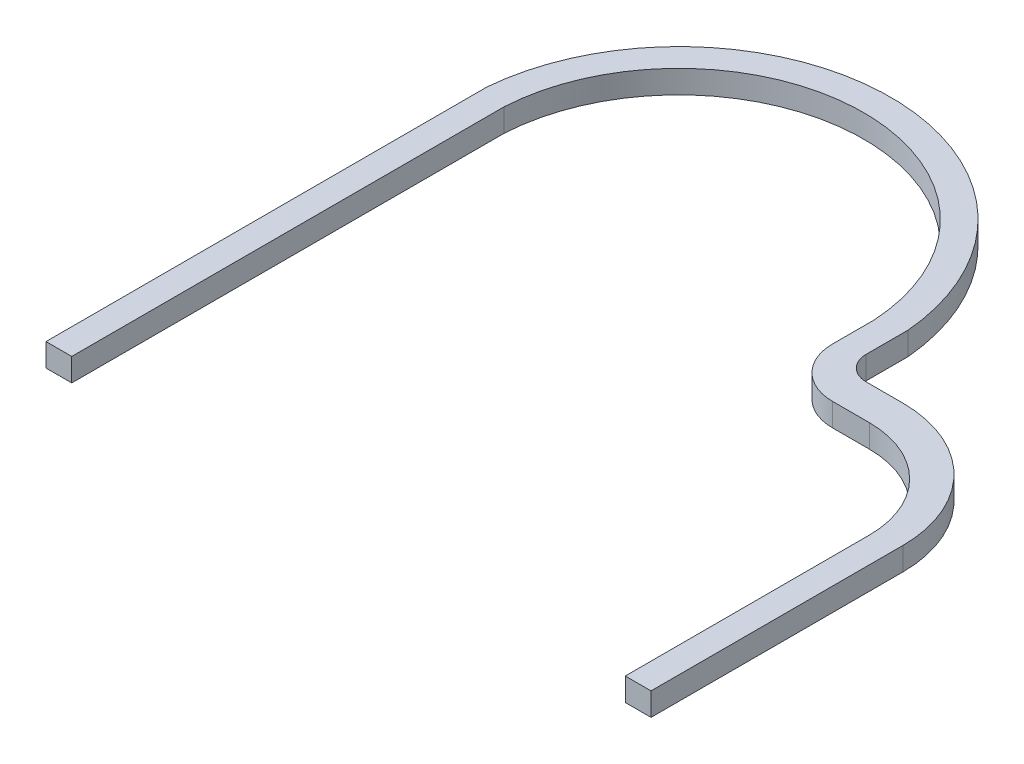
SolidWorks part; units mm, degrees
ref_plane "Front Plane" through (0, 0, 0) normal (0, 0, 1) x (1, 0, 0)
ref_plane "Top Plane" through (0, 0, 0) normal (0, 1, 0) x (1, 0, 0)
ref_plane "Right Plane" through (0, 0, 0) normal (1, 0, 0) x (0, 0, -1)
sketch "circuit outline" plane through (0, 0, 0) normal (0, 1, 0) x (1, 0, 0)
  line L0 (-69.85, 0) -> (-69.85, 15.875)
  line L1 (0, -31.75) -> (-69.85, -31.75)
  line L2 (0, -31.75) -> (0, 0)
  line L3 (0, 0) -> (-17.78, 0)
  line L4 (-69.85, -31.75) -> (-69.85, 0)
  line L5 (-25.4, 15.875) -> (-25.4, 7.62)
  arc A0 (-25.4, 15.875) -> (-69.85, 15.875) centre (-47.625, 15.875) ccw
  arc A1 (-17.78, 0) -> (-25.4, 7.62) centre (-17.78, 7.62) cw
  point P6 (-47.625, 38.1)
  dimension "D3" = 44.45
  dimension "D5" = 7.62
  dimension "D1" = 38.1
  dimension "D2" = 69.85
  dimension "D4" = 31.75
sketch "Sketch2" plane through (0, 0, 0) normal (0, 1, 0) x (1, 0, 0)
  line L0 (0, -31.75) -> (0, 0) construction
  line L1 (0, -31.75) -> (0, 0) construction
  line L2 (0, -31.75) -> (-69.85, -31.75) construction
  line L3 (-69.85, -31.75) -> (-69.85, 0) construction
  line L4 (-69.85, 0) -> (-69.85, 15.875) construction
  line L5 (-25.4, 15.875) -> (-25.4, 7.62) construction
  line L6 (0, 0) -> (-17.78, 0) construction
  line L7 (0, -31.75) -> (-69.85, -31.75) construction
  line L8 (-69.85, -31.75) -> (-69.85, 0) construction
  line L9 (-69.85, 0) -> (-69.85, 15.875) construction
  line L10 (-25.4, 15.875) -> (-25.4, 7.62) construction
  line L11 (0, 0) -> (-17.78, 0) construction
  line L12 (5.08, -36.83) -> (5.08, -10.16)
  line L13 (-10.16, 5.08) -> (-15.24, 5.08)
  line L14 (-20.32, 15.875) -> (-20.32, 10.16)
  line L15 (-74.93, 0) -> (-74.93, 15.875)
  line L16 (-74.93, -36.83) -> (-74.93, 0)
  line L17 (5.08, -36.83) -> (-74.93, -36.83)
  line L19 (-76.708, -38.608) -> (6.858, -38.608)
  line L20 (-76.708, -38.608) -> (-76.708, -35.433)
  line L21 (-18.542, 15.9538) -> (-18.542, 10.16)
  line L22 (-76.708, 0) -> (-76.708, 15.9538)
  line L23 (-76.708, -38.608) -> (-76.708, 0)
  line L24 (6.858, -38.608) -> (-76.708, -38.608)
  line L25 (6.858, -38.608) -> (6.858, -10.16)
  line L26 (-10.16, 6.858) -> (-15.24, 6.858)
  line L27 (-22.098, 14.7785) -> (-22.098, 9.0635)
  line L28 (-73.152, -1.0965) -> (-73.152, 14.7785)
  line L29 (-73.152, -36.1485) -> (-73.152, -1.0965)
  line L30 (3.302, -36.1485) -> (-73.152, -36.1485)
  line L31 (3.302, -36.1485) -> (3.302, -11.2565)
  line L32 (-10.16, 2.2055) -> (-15.24, 2.2055)
  line L33 (-76.708, -35.433) -> (6.858, -35.433)
  line L34 (6.858, -38.608) -> (6.858, -35.433)
  line L35 (-76.708, -35.433) -> (-73.152, -35.433)
  line L36 (-76.708, -35.433) -> (-76.708, -44.958)
  line L37 (-76.708, -44.958) -> (-73.152, -44.958)
  line L38 (-73.152, -35.433) -> (-73.152, -44.958)
  line L39 (6.858, -35.433) -> (3.302, -35.433)
  line L40 (6.858, -35.433) -> (6.858, -44.958)
  line L41 (6.858, -44.958) -> (3.302, -44.958)
  line L42 (3.302, -35.433) -> (3.302, -44.958)
  arc A0 (-25.4, 15.875) -> (-69.85, 15.875) centre (-47.625, 15.875) ccw construction
  arc A1 (-25.4, 7.62) -> (-17.78, 0) centre (-17.78, 7.62) ccw construction
  arc A2 (-25.4, 15.875) -> (-69.85, 15.875) centre (-47.625, 15.875) ccw construction
  arc A3 (-25.4, 7.62) -> (-17.78, 0) centre (-17.78, 7.62) ccw construction
  arc A5 (-20.32, 15.875) -> (-74.93, 15.875) centre (-47.625, 13.4126) ccw
  arc A6 (5.08, -10.16) -> (-10.16, 5.08) centre (-10.16, -10.16) ccw
  arc A8 (-15.24, 5.08) -> (-20.32, 10.16) centre (-15.24, 10.16) cw
  arc A9 (-15.24, 6.858) -> (-18.542, 10.16) centre (-15.24, 10.16) cw
  arc A10 (-18.542, 15.9538) -> (-76.708, 15.9538) centre (-47.625, 13.4126) ccw
  arc A11 (6.858, -10.16) -> (-10.16, 6.858) centre (-10.16, -10.16) ccw
  arc A12 (-15.24, 2.2055) -> (-22.098, 9.0635) centre (-15.24, 9.0635) cw
  arc A13 (-22.098, 14.7785) -> (-73.152, 14.7785) centre (-47.625, 13.335) ccw
  arc A14 (3.302, -11.2565) -> (-10.16, 2.2055) centre (-10.16, -11.2565) ccw
  point P54 (0, 0)
  dimension "D2" = 15.24
  dimension "D3" = 5.08
  dimension "D1" = 3.175
  dimension "D5" = 2.54
  dimension "D6" = 9.525
  dimension "D4" = 1.778
extrude "rim" add sketch "Sketch2" along normal blind 3.175 contours L25 A11 L26 A9 L21 A10 L22 L23 L24 A8 L13 A6 L12 L17 L16 L15 A5 L14 | L13 A8 L14 A5 L15 L16 L17 L12 A6 A14 L31 L30 L29 L28 A13 L27 A12 L32 | L38 L19 L36 L37 | L38 L17 L16 L33 L20 L19 | L38 L29 L33 L16 L17 | L31 L42 L17 L12 L33 | L17 L42 L19 L25 L33 L12 | L19 L42 L41 L40
